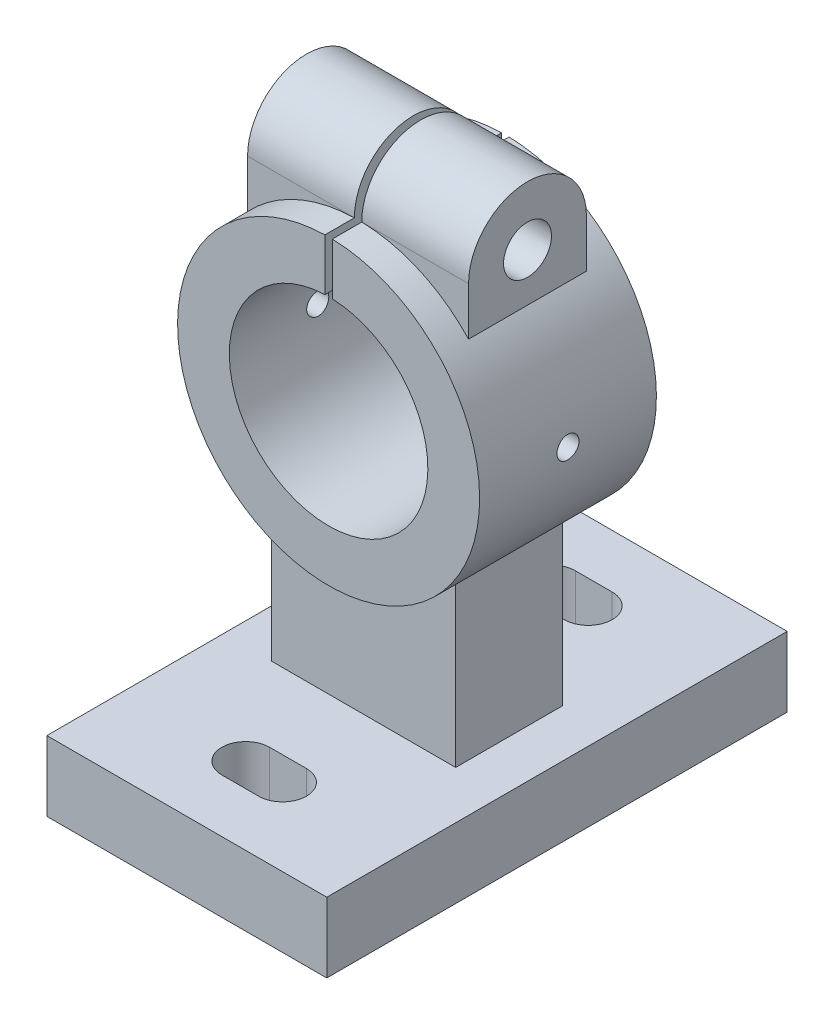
SolidWorks part; units mm, degrees
ref_plane "Front Plane" through (0, 0, 0) normal (0, 0, 1) x (1, 0, 0)
ref_plane "Top Plane" through (0, 0, 0) normal (0, 1, 0) x (1, 0, 0)
ref_plane "Right Plane" through (0, 0, 0) normal (1, 0, 0) x (0, 0, -1)
sketch "Sketch1" plane through (0, 0, 0) normal (0, 0, 1) x (1, 0, 0)
  line L0 (0, 0) -> (0, -95) construction
  line L1 (-25, -32.4962) -> (-25, -76)
  line L2 (25, -32.4962) -> (25, -76)
  line L3 (-25, 0) -> (-25, -95) construction
  line L4 (25, 0) -> (25, -95) construction
  line L5 (-38, -95) -> (38, -95)
  line L6 (38, -95) -> (38, -76)
  line L7 (38, -76) -> (25, -76)
  line L8 (-38, -76) -> (-38, -95)
  line L9 (-25, -76) -> (-38, -76)
  arc A0 (25, -32.4962) -> (-25, -32.4962) centre (0, 0) ccw
  circle A1 centre (0, 0) radius 26.95
  point P14 (0, -95)
  dimension "D1" = 82
  dimension "D2" = 53.9
  dimension "D5" = 95
  dimension "D6" = 76
  dimension "D7" = 19
  dimension "D3" = 25
  dimension "D4" = 25
extrude "Boss-Extrude1" add sketch "Sketch1" along normal mid plane 29
sketch "Sketch2" plane through (0, 0, 0) normal (0, 0, 1) x (1, 0, 0)
  circle A0 centre (0, 0) radius 26.95 construction
  circle A1 centre (0, 0) radius 26.95
  circle A2 centre (0, 0) radius 41
  dimension "D1" = 82
extrude "Boss-Extrude2" add sketch "Sketch2" along normal mid plane 48
sketch "Sketch3" plane through (0, -95, 0) normal (0, -1, 0) x (1, 0, 0)
  line L0 (-38, 14.5) -> (-38, -14.5) construction
  line L1 (-38, 62.5) -> (38, 62.5)
  line L2 (-38, 62.5) -> (-38, -62.5)
  line L3 (-38, -62.5) -> (38, -62.5)
  line L4 (38, 62.5) -> (38, -62.5)
  line L5 (-38, 14.5) -> (38, 14.5) construction
  line L6 (-5, 41.5) -> (5, 41.5) construction
  line L9 (0, -62.5) -> (0, 62.5) construction
  line L10 (-5, 48) -> (5, 48)
  line L13 (-5, 35) -> (5, 35)
  line L14 (0, 0) -> (-25.9349, 0) construction
  line L15 (-5, -41.5) -> (5, -41.5) construction
  line L16 (-5, -48) -> (5, -48)
  line L17 (-5, -35) -> (5, -35)
  arc A4 (-5, 48) -> (-5, 35) centre (-5, 41.5) ccw
  arc A5 (5, 35) -> (5, 48) centre (5, 41.5) ccw
  arc A6 (-5, -48) -> (-5, -35) centre (-5, -41.5) cw
  arc A7 (5, -35) -> (5, -48) centre (5, -41.5) cw
  point P6 (-38, 0)
  point P7 (-38, 0)
  point P10 (0, 14.5)
  point P11 (0, 62.5)
  point P14 (0, 41.5)
  point P28 (0, -41.5)
  dimension "D1" = 125
  dimension "D2" = 76
  dimension "D3" = 13
  dimension "D4" = 10
  dimension "D5" = 21
  dimension "D6" = 33
extrude "Boss-Extrude3" add sketch "Sketch3" against normal blind 19
sketch "Sketch6" plane through (0, 0, 0) normal (1, 0, 0) x (0, 0, -1)
  line L0 (0, 0) -> (0, 41) construction
  line L1 (24, 41) -> (-24, 41) construction
  line L2 (-16, 41) -> (-16, 26.95)
  line L3 (24, 26.95) -> (-24, 26.95) construction
  line L4 (-16, 26.95) -> (16, 26.95)
  line L5 (16, 26.95) -> (16, 41)
  circle A0 centre (0, 41) radius 6.5
  arc A1 (-16, 41) -> (16, 41) centre (0, 41) cw
  dimension "D2" = 13
  dimension "D3" = 16
  dimension "D1" = 41
extrude "Boss-Extrude4" add sketch "Sketch6" along normal mid plane 60
sketch "Sketch7" plane through (0, 0, 0) normal (0, 0, 1) x (1, 0, 0)
  line L0 (0, 26.95) -> (0, 57) construction
  line L1 (30, 57) -> (-30, 57) construction
  line L2 (1, 26.9314) -> (1, 57)
  line L3 (-1, 26.9314) -> (-1, 57)
  line L4 (-1, 57) -> (1, 57)
  line L5 (-1, -0.0318) -> (-1, 57) construction
  line L6 (0, -0.0318) -> (0, 57) construction
  line L7 (1, -0.0318) -> (1, 57) construction
  circle A0 centre (0, 0) radius 26.95 construction
  arc A1 (1, 26.9314) -> (-1, 26.9314) centre (0, 0) ccw
  dimension "D1" = 1
  dimension "D2" = 1
extrude "Cut-Extrude1" cut sketch "Sketch7" against normal mid plane 60
sketch "Sketch8" plane through (0, 0, 0) normal (1, 0, 0) x (0, 0, -1)
  line L0 (0, 0) -> (0, 41) construction
  circle A0 centre (0, 0) radius 3
  dimension "D1" = 6
  dimension "D2" = 41
extrude "Cut-Extrude2" cut sketch "Sketch8" against normal mid plane 110
